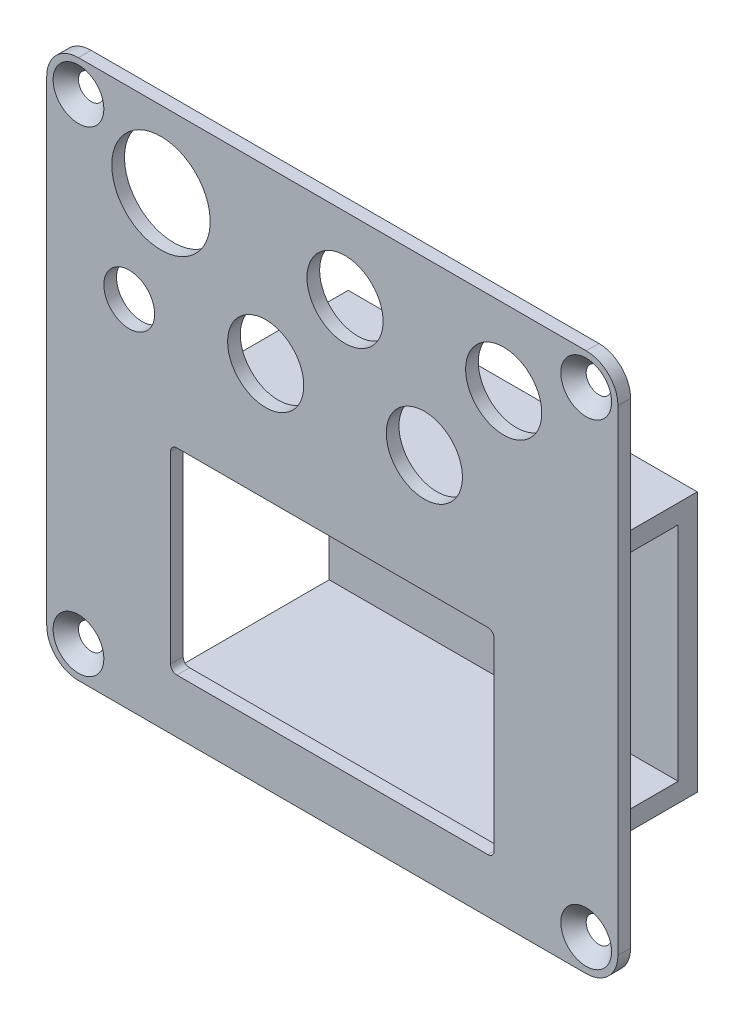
SolidWorks part; units mm, degrees
ref_plane "Спереди" through (0, 0, 0) normal (0, 0, 1) x (1, 0, 0)
ref_plane "Сверху" through (0, 0, 0) normal (0, 1, 0) x (1, 0, 0)
ref_plane "Справа" through (0, 0, 0) normal (1, 0, 0) x (0, 0, -1)
sketch "Эскиз1" plane through (0, 0, 0) normal (0, 0, 1) x (1, 0, 0)
  line L1 (-40, 42.5) -> (40, 42.5)
  line L2 (-45, 37.5) -> (-45, -37.5)
  line L3 (-40, -42.5) -> (40, -42.5)
  line L4 (45, 37.5) -> (45, -37.5)
  line L5 (-45, 42.5) -> (45, -42.5) construction
  line L6 (-45, -42.5) -> (45, 42.5) construction
  arc A0 (40, -42.5) -> (45, -37.5) centre (40, -37.5) ccw
  arc A1 (40, 42.5) -> (45, 37.5) centre (40, 37.5) cw
  arc A2 (-40, 42.5) -> (-45, 37.5) centre (-40, 37.5) ccw
  arc A3 (-45, -37.5) -> (-40, -42.5) centre (-40, -37.5) ccw
  point P0 (0, 0)
  dimension "D3" = 5
  dimension "D1" = 85
  dimension "D2" = 90
extrude "Бобышка-Вытянуть1" add sketch "Эскиз1" along normal blind 2
sketch "Эскиз4" plane through (0, 0, 2) normal (0, 0, 1) x (1, 0, 0)
  circle A0 centre (-40, 37.5) radius 2
  circle A1 centre (40, 37.5) radius 2
  circle A2 centre (40, -37.5) radius 2
  circle A3 centre (-40, -37.5) radius 2
  dimension "D1" = 4
extrude "Вырез-Вытянуть2" cut sketch "Эскиз4" against normal blind 2
chamfer "Фаска2" distance 2 angle 45 4 edges at (-38, -37.5, 2) (42, -37.5, 2) (42, 37.5, 2) (-38, 37.5, 2)
sketch "Эскиз5" plane through (0, 0, 0) normal (0, 0, -1) x (-1, 0, 0)
  line L5 (40, -42.5) -> (-40, -42.5) construction
  line L6 (-27.5, -36) -> (27.5, -36)
  line L11 (-27.5, -36) -> (-27.5, -39)
  line L12 (-27.5, -39) -> (27.5, -39)
  line L15 (27.5, -36) -> (27.5, -39)
  line L16 (-27.5, -36) -> (27.5, -39) construction
  line L17 (-27.5, -39) -> (27.5, -36) construction
  line L18 (-27.5, 2) -> (27.5, 2)
  line L19 (-27.5, 2) -> (-27.5, -1)
  line L20 (-27.5, -1) -> (27.5, -1)
  line L21 (27.5, 2) -> (27.5, -1)
  line L22 (-27.5, 2) -> (27.5, -1) construction
  line L23 (-27.5, -1) -> (27.5, 2) construction
  point P0 (0, -37.5)
  point P6 (0, 0.5)
  dimension "D1" = 3
  dimension "D2" = 55
  dimension "D3" = 35
  dimension "D4" = 5
extrude "Бобышка-Вытянуть2" add sketch "Эскиз5" along normal blind 25
sketch "Эскиз6" plane through (0, 0, 0) normal (0, 0, -1) x (-1, 0, 0)
  line L0 (27.5, -36) -> (-27.5, -36) construction
  line L1 (-25.5, -3) -> (25.5, -3)
  line L2 (-25.5, -3) -> (-25.5, -34)
  line L3 (-25.5, -34) -> (25.5, -34)
  line L4 (25.5, -3) -> (25.5, -34)
  line L5 (-25.5, -3) -> (25.5, -34) construction
  line L6 (-25.5, -34) -> (25.5, -3) construction
  point P0 (0, -18.5)
  dimension "D1" = 17.5
  dimension "D2" = 51
  dimension "D3" = 31
extrude "Вырез-Вытянуть3" cut sketch "Эскиз6" against normal through all
sketch "Эскиз7" plane through (0, 0, -25) normal (0, 0, -1) x (-1, 0, 0)
  line L1 (-27.5, 2) -> (27.5, 2)
  line L2 (-27.5, 2) -> (-27.5, -39)
  line L3 (-27.5, -39) -> (27.5, -39)
  line L4 (27.5, 2) -> (27.5, -39)
extrude "Бобышка-Вытянуть3" add sketch "Эскиз7" along normal blind 3
fillet "Скругление1" radius 1 4 edges at (25.5, -34, 1) (-25.5, -34, 1) (-25.5, -3, 1) (25.5, -3, 1)
sketch "Эскиз8" plane through (0, 0, 0) normal (0, 0, -1) x (-1, 0, 0)
  line L0 (-40, 42.5) -> (40, 42.5) construction
  line L1 (-45, -37.5) -> (-45, 37.5) construction
  line L2 (45, 37.5) -> (45, -37.5) construction
  circle A0 centre (-27, 30.5) radius 6
  circle A1 centre (-14.5, 15.5) radius 6
  circle A2 centre (-2, 30.5) radius 6
  circle A3 centre (10.5, 15.5) radius 6
  circle A4 centre (-27, 30.5) radius 8.5 construction
  circle A5 centre (-14.5, 15.5) radius 8.5 construction
  circle A6 centre (-2, 30.5) radius 8.5 construction
  circle A7 centre (10.5, 15.5) radius 8.5 construction
  circle A8 centre (27, 30.5) radius 7.75
  dimension "D1" = 12
  dimension "D2" = 17
  dimension "D9" = 15.5
  dimension "D3" = 12
  dimension "D4" = 18
  dimension "D5" = 25
  dimension "D6" = 12.5
  dimension "D7" = 15
  dimension "D8" = 25
  dimension "D10" = 18
extrude "Вырез-Вытянуть4" cut sketch "Эскиз8" against normal through all
sketch "Эскиз9" plane through (0, 0, 0) normal (0, 0, -1) x (-1, 0, 0)
  circle A0 centre (32, 13.5) radius 4
  circle A6 centre (27, 30.5) radius 7.75 construction
  dimension "D1" = 8
  dimension "D2" = 5
  dimension "D3" = 17
extrude "Вырез-Вытянуть5" cut sketch "Эскиз9" against normal through all
